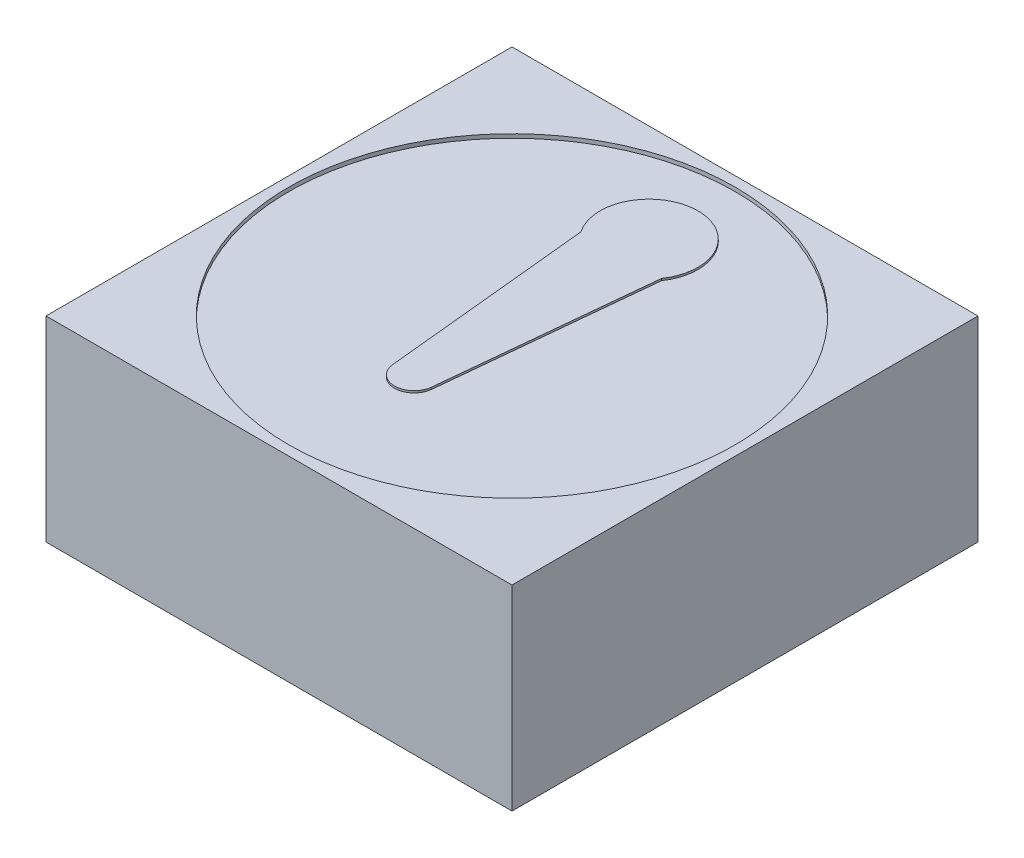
SolidWorks part; units mm, degrees
ref_plane "Plan de face" through (0, 0, 0) normal (0, 0, 1) x (1, 0, 0)
ref_plane "Plan de dessus" through (0, 0, 0) normal (0, 1, 0) x (1, 0, 0)
ref_plane "Plan de droite" through (0, 0, 0) normal (1, 0, 0) x (0, 0, -1)
sketch "Esquisse1" plane through (0, 0, 0) normal (0, 1, 0) x (1, 0, 0)
  line L1 (-1.19, -1.19) -> (1.19, -1.19)
  line L2 (-1.19, -1.19) -> (-1.19, 1.19)
  line L3 (-1.19, 1.19) -> (1.19, 1.19)
  line L4 (1.19, -1.19) -> (1.19, 1.19)
  line L5 (-1.19, -1.19) -> (1.19, 1.19) construction
  line L6 (-1.19, 1.19) -> (1.19, -1.19) construction
  point P0 (0, 0)
  dimension "D1" = 2.38
  dimension "D2" = 2.38
extrude "Boss.-Extru.1" add sketch "Esquisse1" along normal blind 1
sketch "Esquisse2" plane through (0, 1, 0) normal (0, 1, 0) x (1, 0, 0)
  circle A0 centre (0, 0) radius 1.14
  dimension "D1" = 2.28
extrude "Enlèv. mat.-Extru.1" cut sketch "Esquisse2" against normal blind 0.2
sketch "Esquisse3" plane through (0, 0.8, 0) normal (0, 1, 0) x (1, 0, 0)
  circle A0 centre (0, 0) radius 1.14
  circle A1 centre (0, 0) radius 1.14 construction
extrude "Boss.-Extru.2" add sketch "Esquisse3" along normal blind 0.18
sketch "Esquisse4" plane through (0, 0.98, 0) normal (0, 1, 0) x (1, 0, 0)
  line L0 (0, -1.3325) -> (0, 1.3154) construction
  line L1 (-0.0995, -0.5099) -> (-0.206, 0.5584)
  line L2 (0.0995, -0.5099) -> (0.206, 0.5584)
  arc A0 (0.206, 0.5584) -> (-0.206, 0.5584) centre (0, 0.7) ccw
  arc A1 (-0.0995, -0.5099) -> (0.0995, -0.5099) centre (0, -0.5) ccw
  dimension "D1" = 0.5
  dimension "D3" = 0.2
  dimension "D2" = 0.7
  dimension "D4" = 0.5
extrude "Boss.-Extru.3" add sketch "Esquisse4" along normal blind 0.01
